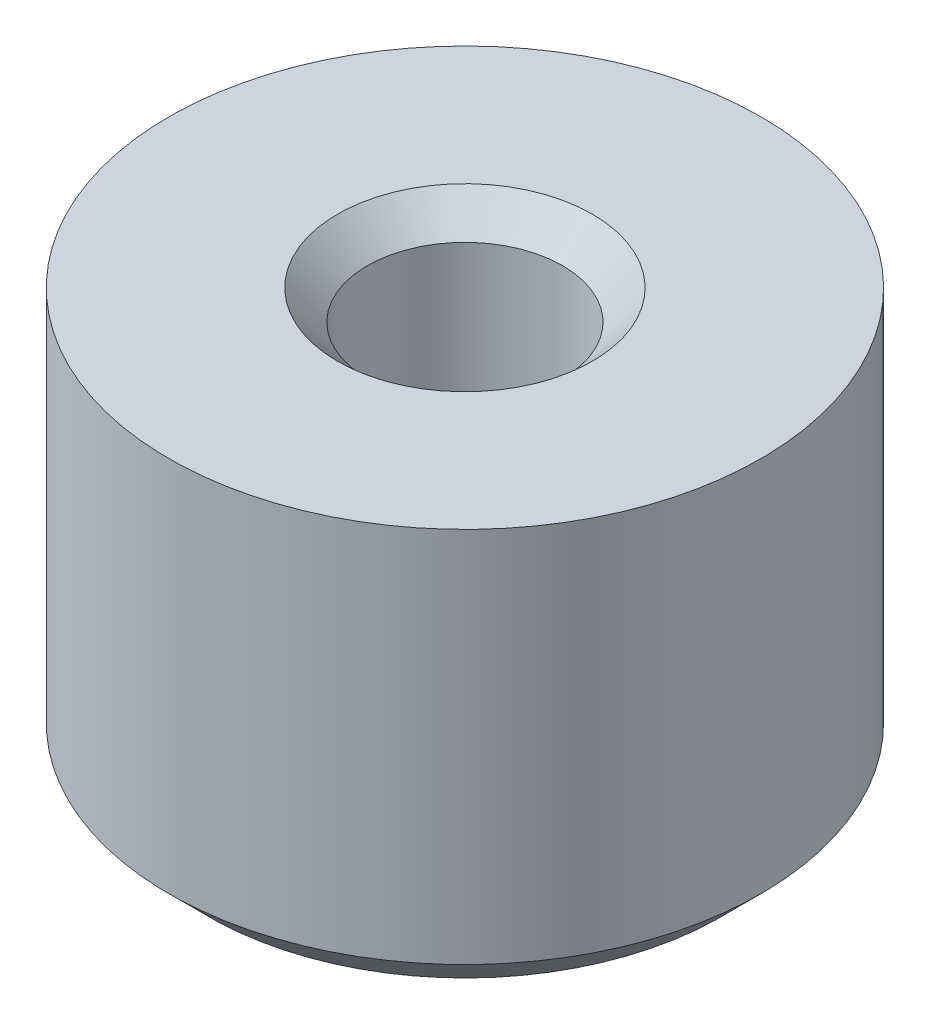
SolidWorks part; units mm, degrees
ref_plane "Plan de face" through (0, 0, 0) normal (0, 0, 1) x (1, 0, 0)
ref_plane "Plan de dessus" through (0, 0, 0) normal (0, 1, 0) x (1, 0, 0)
ref_plane "Plan de droite" through (0, 0, 0) normal (1, 0, 0) x (0, 0, -1)
sketch "Esquisse1" plane through (0, 0, 0) normal (0, 0, 1) x (1, 0, 0)
  line L0 (0, 0) -> (0, 26) construction
  line L1 (-7.8951, 26) -> (-6.425, 26)
  line L2 (-4.925, 24.5) -> (-4.925, 11)
  line L3 (-1.925, 8) -> (-1.5, 8)
  line L4 (-7.5, 5) -> (-1.5, 5)
  line L7 (-7.8951, 26) -> (-14.925, 26)
  line L8 (-14.925, 26) -> (-14.925, 7)
  line L9 (-12.925, 5) -> (-7.5, 5)
  line L11 (-14.925, 7) -> (-12.925, 5)
  line L12 (-6.425, 26) -> (-4.925, 24.5)
  line L13 (-1.5, 8) -> (-1.5, 5)
  arc A0 (-4.925, 11) -> (-1.925, 8) centre (-1.925, 11) ccw
  point P4 (-4.925, 26)
  point P8 (-7.5, 0)
  point P10 (-4.925, 8)
  point P13 (-14.925, 5)
  dimension "D5" = 3
  dimension "D1" = 9.85
  dimension "D3" = 21
  dimension "D4" = 18
  dimension "D6" = 10
  dimension "D7" = 5
  dimension "D8" = 3
revolve "Révolution1" add sketch "Esquisse1" angle 360 about L0
